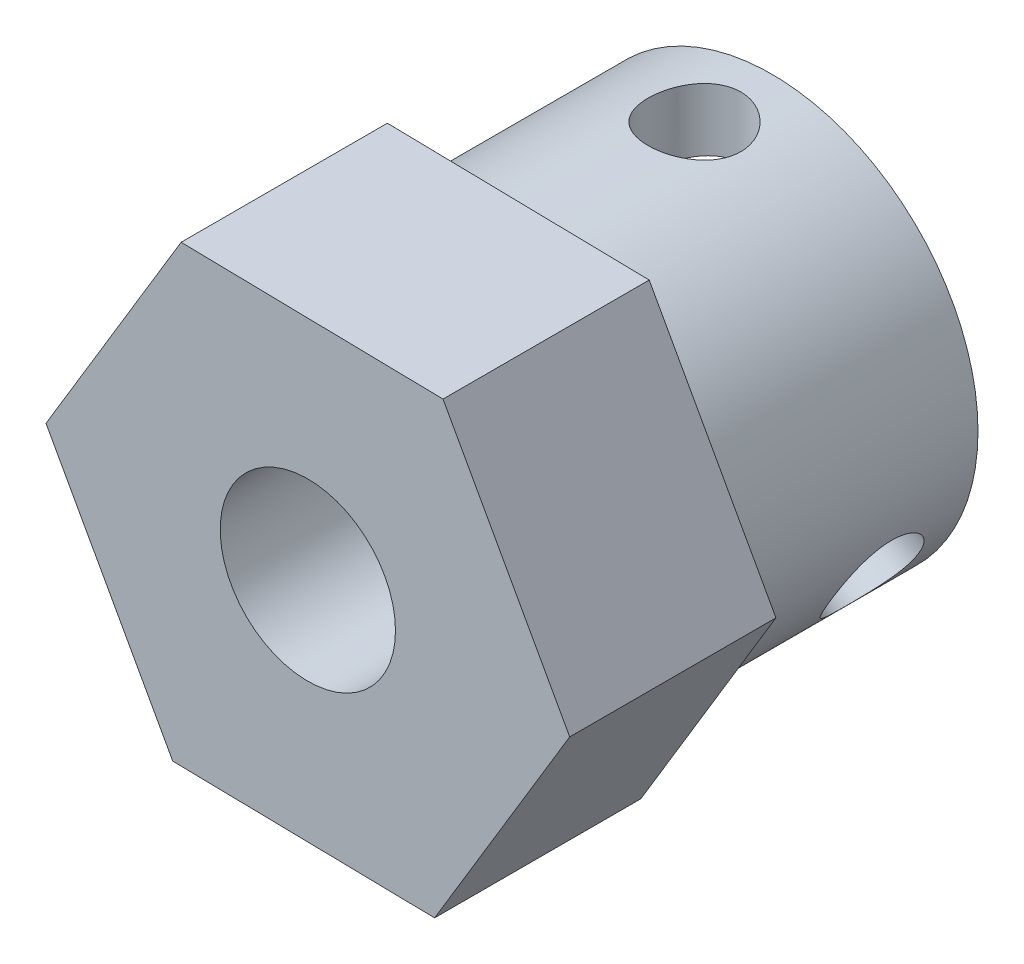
SolidWorks part; units mm, degrees
ref_plane "Front Plane" through (0, 0, 0) normal (0, 0, 1) x (1, 0, 0)
ref_plane "Top Plane" through (0, 0, 0) normal (0, 1, 0) x (1, 0, 0)
ref_plane "Right Plane" through (0, 0, 0) normal (1, 0, 0) x (0, 0, -1)
sketch "Sketch2" plane through (0, 0, 0) normal (0, 0, 1) x (1, 0, 0)
  circle A0 centre (0, 0) radius 5.08
  dimension "D1" = 10.16
extrude "Boss-Extrude2" add sketch "Sketch2" against normal blind 8.89
sketch "Sketch3" plane through (0, 0, -8.89) normal (0, 0, -1) x (-1, 0, 0)
  circle A0 centre (0, 0) radius 3.556
  dimension "D1" = 7.112
sketch "Sketch5" plane through (0, 0, 0) normal (0, 0, 1) x (1, 0, 0)
  line L1 (6.4514, -0.12) -> (3.3296, 5.527)
  line L2 (3.3296, 5.527) -> (-3.1218, 5.647)
  line L3 (-3.1218, 5.647) -> (-6.4514, 0.12)
  line L4 (-6.4514, 0.12) -> (-3.3296, -5.527)
  line L5 (-3.3296, -5.527) -> (3.1218, -5.647)
  line L6 (3.1218, -5.647) -> (6.4514, -0.12)
  circle A0 centre (0, 0) radius 5.588 construction
  dimension "D1" = 11.176
extrude "Boss-Extrude3" add sketch "Sketch5" along normal blind 2.54 and the other way blind 2.54
extrude "Cut-Extrude3" cut sketch "Sketch3" against normal blind 7.874
sketch "Sketch6" plane through (0, 0, 2.54) normal (0, 0, 1) x (1, 0, 0)
  circle A0 centre (0, 0) radius 2.159
  dimension "D1" = 4.318
extrude "Cut-Extrude4" cut sketch "Sketch6" against normal through all
sketch "Sketch7" plane through (0, 0, 0) normal (0, 1, 0) x (1, 0, 0)
  line L0 (5.08, 8.89) -> (-5.08, 8.89) construction
  circle A0 centre (0, 6.985) radius 1.143
  dimension "D1" = 2.286
  dimension "D2" = 1.905
extrude "Cut-Extrude5" cut sketch "Sketch7" along normal through all
pattern_circular "CirPattern1" count 3 every 120 about axis through (0, 0, -8.89) along (0, 0, 1) of "Cut-Extrude5"
